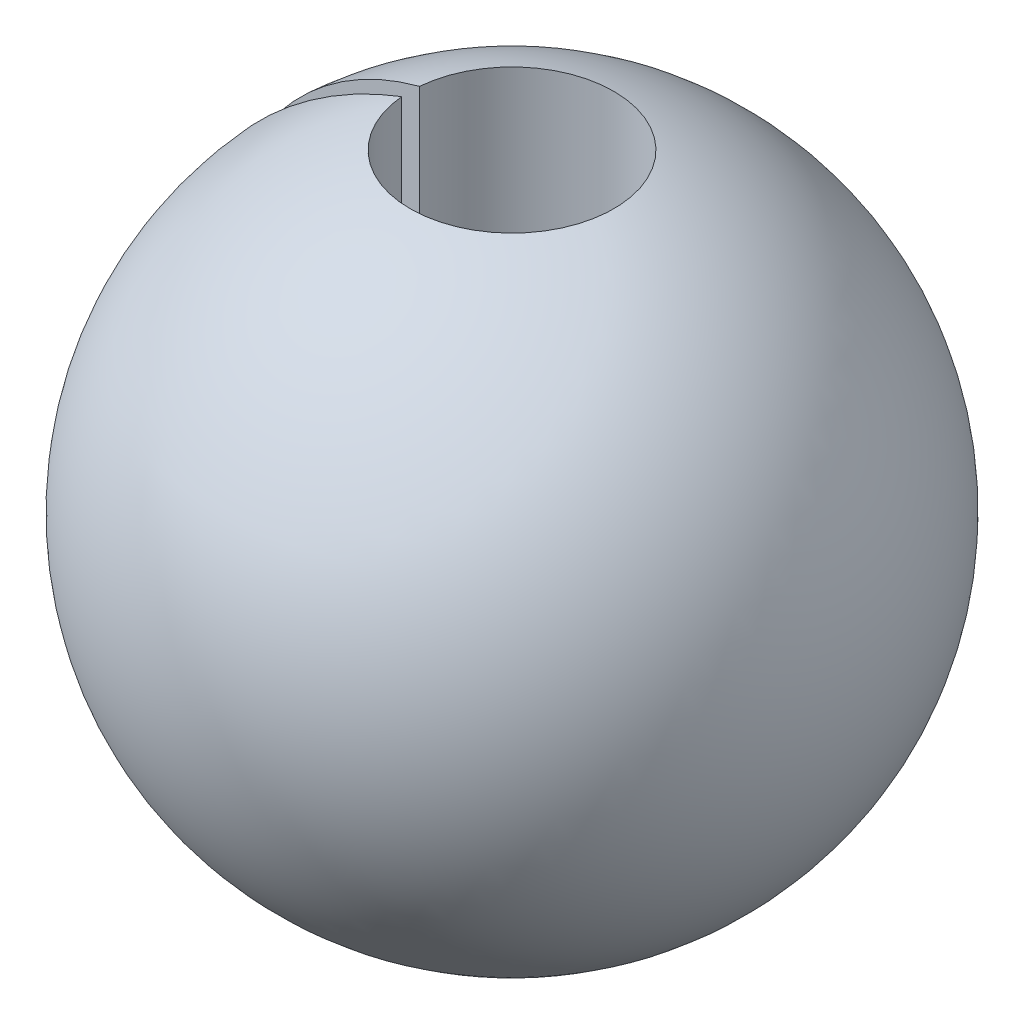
SolidWorks part; units mm, degrees
ref_plane "前视基准面" through (0, 0, 0) normal (0, 0, 1) x (1, 0, 0)
ref_plane "上视基准面" through (0, 0, 0) normal (0, 1, 0) x (1, 0, 0)
ref_plane "右视基准面" through (0, 0, 0) normal (1, 0, 0) x (0, 0, -1)
sketch "草图2" plane through (0, 0, 0) normal (1, 0, 0) x (0, 0, -1)
  line L0 (0, -6735.6575) -> (0, 330047.218) construction
  line L1 (-202, 622.0225) -> (-202, -622.0225)
  arc A0 (-202, 622.0225) -> (-202, -622.0225) centre (0, 0) ccw
  dimension "D1" = 1308
  dimension "D2" = 202
revolve "旋转1" add sketch "草图2" angle 360 about L0
sketch "草图3" plane through (0, 0, 0) normal (0, 1, 0) x (1, 0, 0)
  line L0 (0, 0) -> (-823.993, 72.09)
  line L1 (-823.993, 72.09) -> (-823.993, -72.09)
  line L2 (-823.993, -72.09) -> (0, 0)
  line L3 (-684.2248, 0) -> (684.2248, 0) construction
  dimension "D1" = 10
  dimension "D2" = 5
  dimension "D3" = 144.1801
extrude "切除-拉伸1" cut sketch "草图3" against normal mid plane 2014
